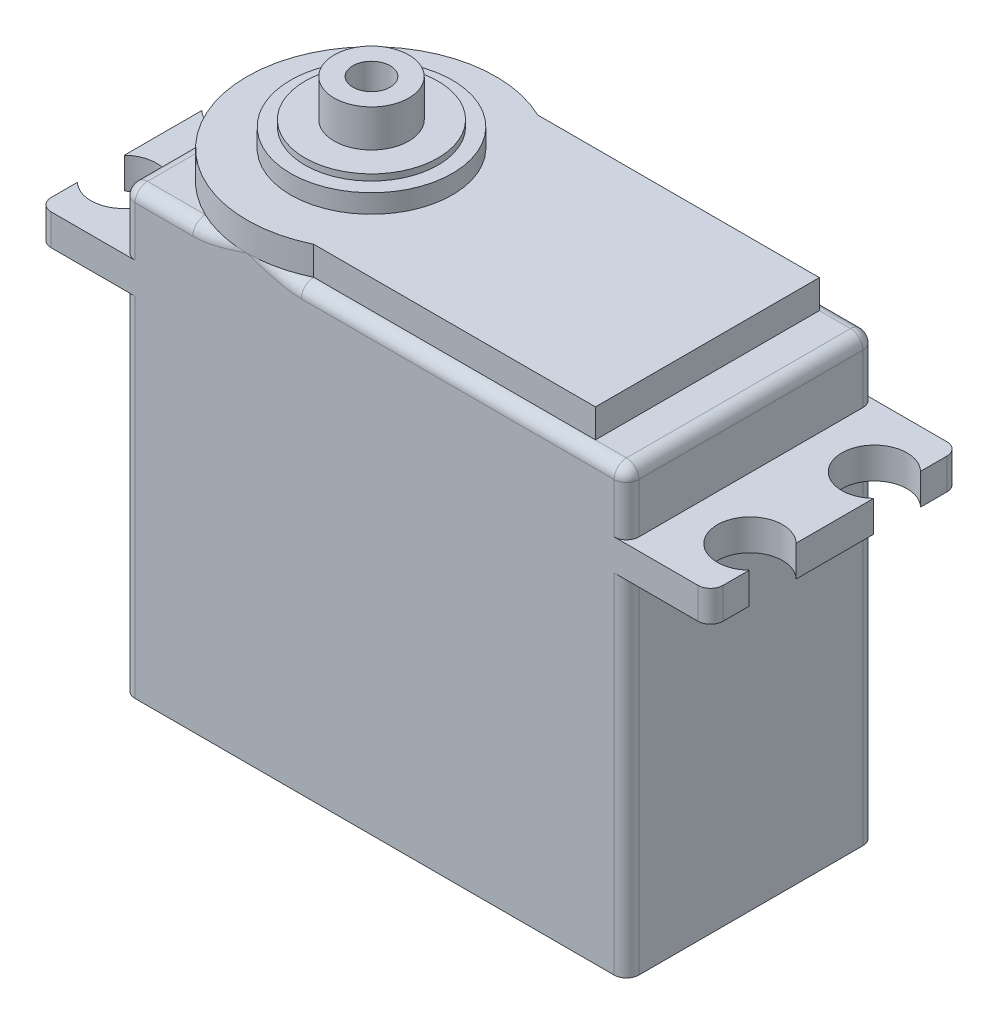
SolidWorks part; units mm, degrees
ref_plane "Front Plane" through (0, 0, 0) normal (0, 0, 1) x (1, 0, 0)
ref_plane "Top Plane" through (0, 0, 0) normal (0, 1, 0) x (1, 0, 0)
ref_plane "Right Plane" through (0, 0, 0) normal (1, 0, 0) x (0, 0, -1)
sketch "Sketch2" plane through (0, 0, 0) normal (0, 1, 0) x (1, 0, 0)
  line L0 (-20.25, 10) -> (20.25, -10) construction
  line L1 (-20.25, 10) -> (20.25, 10)
  line L2 (-20.25, 10) -> (-20.25, -10)
  line L3 (-20.25, -10) -> (20.25, -10)
  line L4 (20.25, 10) -> (20.25, -10)
  line L5 (20.25, 10) -> (-20.25, -10) construction
  point P5 (0, 0)
  dimension "D1" = 20
  dimension "D2" = 40.5
extrude "Boss-Extrude1" add sketch "Sketch2" along normal blind 37
sketch "Sketch3" plane through (0, 0, 0) normal (0, -1, 0) x (1, 0, 0)
  line L0 (-20.25, -10) -> (-20.25, 10) construction
  line L1 (-20.25, 10) -> (20.25, 10) construction
  line L2 (20.25, -10) -> (-20.25, -10) construction
  line L3 (20.25, 10) -> (20.25, -10) construction
  line L4 (20.25, -10) -> (16.1, -10)
  line L5 (20.25, 10) -> (20.25, 5.85)
  line L6 (-20.25, 10) -> (-16.1, 10)
  line L7 (-20.25, -10) -> (-20.25, -5.85)
  line L8 (20.25, -5.85) -> (20.25, -10)
  line L9 (16.1, 10) -> (20.25, 10)
  line L10 (-20.25, 5.85) -> (-20.25, 10)
  line L11 (-16.1, -10) -> (-20.25, -10)
  arc A0 (-20.25, 5.85) -> (-16.1, 10) centre (-20.25, 10) ccw
  arc A1 (-20.25, -5.85) -> (-16.1, -10) centre (-20.25, -10) cw
  arc A2 (16.1, -10) -> (20.25, -5.85) centre (20.25, -10) cw
  arc A3 (16.1, 10) -> (20.25, 5.85) centre (20.25, 10) ccw
  dimension "D1" = 4.15
extrude "Cut-Extrude1" cut sketch "Sketch3" against normal blind 1.5
chamfer "Chamfer1" distance 1.5 angle 45 4 edges at (-20.25, 0, 0) (0, 0, 10) (20.25, 0, 0) (0, 0, -10)
sketch "Sketch4" plane through (0, 37, 0) normal (0, 1, 0) x (1, 0, 0)
  line L0 (-20.25, 10) -> (-20.25, -10) construction
  line L1 (16.75, -9) -> (-5.8911, -9)
  line L2 (16.75, -9) -> (16.75, 9)
  line L3 (16.75, 9) -> (-5.8911, 9)
  line L5 (20.25, 10) -> (-20.25, 10) construction
  line L6 (-20.25, -10) -> (20.25, -10) construction
  line L7 (-20.25, 10) -> (-20.25, -10) construction
  line L8 (20.25, 10) -> (-20.25, 10) construction
  line L9 (-10.7071, -10) -> (20.25, -10) construction
  line L10 (20.25, -10) -> (20.25, 10) construction
  arc A1 (-5.8911, 9) -> (-5.8911, -9) centre (-10.25, 0) ccw
  dimension "D4" = 3.5
  dimension "D1" = 18
  dimension "D3" = 1
extrude "Boss-Extrude2" add sketch "Sketch4" along normal blind 2.3
sketch "Sketch5" plane through (0, 39.3, 0) normal (0, 1, 0) x (1, 0, 0)
  line L0 (-5.8911, -9) -> (16.75, -9) construction
  line L1 (16.75, -9) -> (16.75, 9) construction
  line L2 (16.75, 9) -> (-5.8911, 9) construction
  line L3 (-5.8911, -9) -> (16.75, -9) construction
  line L4 (16.75, -9) -> (16.75, 9) construction
  line L5 (16.75, 9) -> (-5.8911, 9)
  arc A0 (-5.8911, 9) -> (-5.8911, -9) centre (-10.25, 0) ccw construction
  arc A1 (-5.8911, 9) -> (-5.8911, -9) centre (-10.25, 0) ccw
  circle A2 centre (-10.25, 0) radius 6.5
  dimension "D1" = 13
extrude "Boss-Extrude3" add sketch "Sketch5" along normal blind 1.5 contours A2
sketch "Sketch6" plane through (0, 40.8, 0) normal (0, 1, 0) x (1, 0, 0)
  circle A0 centre (-10.25, 0) radius 6.5 construction
  circle A1 centre (-10.25, 0) radius 6.5 construction
  circle A2 centre (-10.25, 0) radius 5.35
  dimension "D1" = 10.7
extrude "Boss-Extrude4" add sketch "Sketch6" along normal blind 0.5
sketch "Sketch7" plane through (0, 41.3, 0) normal (0, 1, 0) x (1, 0, 0)
  circle A0 centre (-10.25, 0) radius 3
  circle A1 centre (-10.25, 0) radius 5.35
  circle A2 centre (-10.25, 0) radius 5.35 construction
  circle A3 centre (-10.25, 0) radius 1.5
  dimension "D2" = 6
  dimension "D3" = 3
  dimension "D1" = 0
extrude "Boss-Extrude5" add sketch "Sketch7" along normal blind 3
sketch "Sketch8" plane through (-20.25, 0, 0) normal (-1, 0, 0) x (0, 0, 1)
  line L0 (-10, 37) -> (0, 37) construction
  line L1 (0, 37) -> (10, 37) construction
  line L2 (10, 37) -> (10, 1.5) construction
  line L3 (-10, 37) -> (-10, 1.5) construction
  line L4 (-10, 37) -> (0, 37) construction
  line L5 (0, 37) -> (10, 37) construction
  line L6 (10, 37) -> (10, 1.5)
  line L7 (-10, 37) -> (-10, 1.5) construction
  line L9 (10, 29.5) -> (-10, 29.5)
  line L10 (10, 29.5) -> (10, 32)
  line L11 (10, 32) -> (-10, 32)
  line L12 (-10, 29.5) -> (-10, 32)
  dimension "D1" = 2.5
  dimension "D2" = 5
extrude "Boss-Extrude6" add sketch "Sketch8" along normal blind 6.75 contours L6 L11 L9 M11
sketch "Sketch9" plane through (20.25, 0, 0) normal (1, 0, 0) x (0, 0, -1)
  line L0 (-9, 37) -> (9, 37) construction
  line L1 (-9, 37) -> (9, 37) construction
  line L2 (-10, 37) -> (-10, 1.5) construction
  line L3 (-10, 29.5) -> (10, 29.5)
  line L4 (-10, 29.5) -> (-10, 32)
  line L5 (-10, 32) -> (10, 32)
  line L6 (10, 29.5) -> (10, 32)
  line L7 (10, 37) -> (10, 1.5) construction
  dimension "D1" = 2.5
  dimension "D2" = 5
extrude "Boss-Extrude7" add sketch "Sketch9" along normal blind 6.75
sketch "Sketch10" plane through (0, 32, 0) normal (0, 1, 0) x (1, 0, 0)
  line L1 (-27, 10) -> (-20.25, 10) construction
  line L2 (-27, -10) -> (-20.25, -10) construction
  line L3 (-20.25, 10) -> (-20.25, 0) construction
  circle A0 centre (-25.175, 5) radius 2.625
  circle A1 centre (-25.175, -5) radius 2.625
  dimension "D1" = 5
  dimension "D3" = 5.25
  dimension "D2" = 5
  dimension "7.2" = 4.925
extrude "Cut-Extrude2" cut sketch "Sketch10" against normal up to next
sketch "Sketch11" plane through (0, 32, 0) normal (0, 1, 0) x (1, 0, 0)
  line L1 (27, -10) -> (20.25, -10) construction
  line L2 (27, 10) -> (20.25, 10) construction
  line L3 (20.25, -10) -> (20.25, 10) construction
  circle A0 centre (25.175, -5) radius 2.625
  circle A1 centre (25.175, 5) radius 2.625
  dimension "D1" = 5
  dimension "D3" = 5.25
  dimension "D2" = 5
  dimension "D4" = 4.925
extrude "Cut-Extrude3" cut sketch "Sketch11" against normal up to next
fillet "Fillet1" radius 1 15 edges at (-20.25, 37, 5) (-15.25, 37, 10) (-15.25, 37, -10) (20.25, 37, 0) (-20.25, 37, -5) (5, 37, 10) (5, 37, -10) (20.25, 34.5, -10) (20.25, 15.5, -10) (20.25, 34.5, 10) (20.25, 15.5, 10) (-20.25, 34.5, 10) (-20.25, 15.5, 10) (-20.25, 34.5, -10) (-20.25, 15.5, -10)
fillet "Fillet2" radius 1 4 edges at (-27, 30.75, -10) (-27, 30.75, 10) (27, 30.75, 10) (27, 30.75, -10)
sketch "Sketch12" plane through (-20.25, 0, 0) normal (-1, 0, 0) x (0, 0, 1)
  line L0 (-9, 29.5) -> (-9, 1.5) construction
  line L1 (-3.5, 8.5) -> (3.5, 8.5)
  line L2 (-3.5, 8.5) -> (-3.5, 4.5)
  line L3 (-3.5, 4.5) -> (3.5, 4.5)
  line L4 (3.5, 8.5) -> (3.5, 4.5)
  line L6 (9, 29.5) -> (-9, 29.5) construction
  dimension "D1" = 7
  dimension "D2" = 4
  dimension "D3" = 5.5
  dimension "21" = 21
extrude "Boss-Extrude8" add sketch "Sketch12" along normal blind 4
